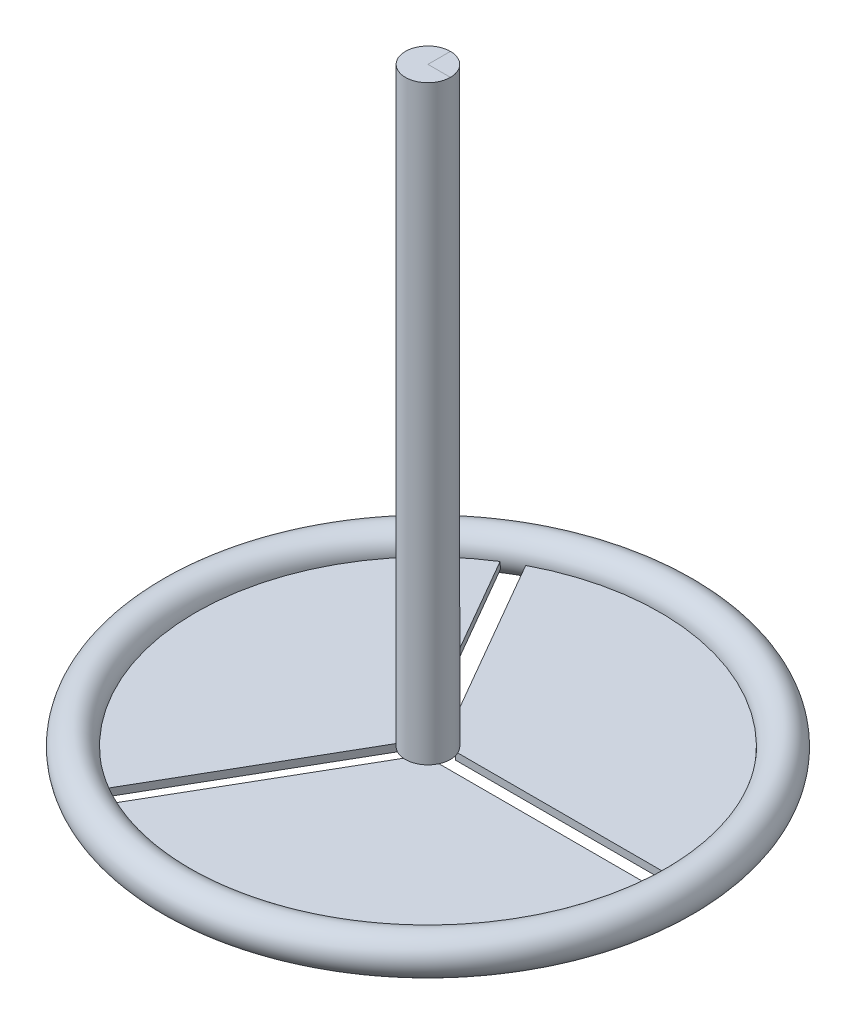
SolidWorks part; units mm, degrees
ref_plane "Front Plane" through (0, 0, 0) normal (0, 0, 1) x (1, 0, 0)
ref_plane "Top Plane" through (0, 0, 0) normal (0, 1, 0) x (1, 0, 0)
ref_plane "Right Plane" through (0, 0, 0) normal (1, 0, 0) x (0, 0, -1)
ref_plane "Plane1" through (0, 193.5413, -979.8028) normal (0, -0.1938, 0.981) x (1, 0, 0)
sketch "Sketch1" plane through (0, 0, -1215.3142) normal (0, 1, 0) x (1, 0, 0)
  line L0 (-200.97, -1215.3142) -> (200.97, -1215.3142) construction
  line L1 (0, -1416.2842) -> (0, -1014.3442) construction
  circle A0 centre (0, -1215.3142) radius 170
extrude "Extrude1" add sketch "Sketch1" against normal blind 5
sketch "Sketch3" plane through (0, -5, 0) normal (0, -1, 0) x (-1, 0, 0)
  circle A0 centre (0, 0) radius 13.97
  dimension "D1" = 27.94
extrude "Cut-Extrude1" cut sketch "Sketch3" against normal through all
sketch "Sketch4" plane through (0, -5, 0) normal (0, -1, 0) x (-1, 0, 0)
  line L0 (0, 0) -> (548.0113, 0) construction
  line L1 (0, 0) -> (84.3463, -146.0921) construction
  line L2 (0, 0) -> (504.6147, 874.0183) construction
  line L4 (725.1893, 497.3832) -> (737.8893, 497.3832)
  line L5 (725.1893, 497.3832) -> (800.3254, 627.5227)
  line L6 (800.3254, 627.5227) -> (813.0254, 627.5227)
  line L7 (737.8893, 497.3832) -> (813.0254, 627.5227)
  line L8 (572.2578, -6.35) -> (720.7058, -6.35)
  line L9 (572.2578, -6.35) -> (572.2578, 6.35)
  line L10 (572.2578, 6.35) -> (720.7058, 6.35)
  line L11 (720.7058, -6.35) -> (720.7058, 6.35)
  line L12 (75.1174, -142.8063) -> (86.0439, -136.3331)
  line L13 (75.1174, -142.8063) -> (-5.4632, -3.2366)
  line L14 (-5.4632, -3.2366) -> (5.4632, 3.2366)
  line L15 (86.0439, -136.3331) -> (5.4632, 3.2366)
  dimension "D1" = 120
  dimension "D2" = 120
  dimension "D3" = 12.7
  dimension "D4" = 12.7
  dimension "D5" = 12.7
extrude "Cut-Extrude2" cut sketch "Sketch4" against normal through all
pattern_circular "CirPattern1" count 3 over 360 about axis through (0, 0, 0) along (0, 1, 0) of "Cut-Extrude2"
sketch "Sketch6" plane through (0, 0, 0) normal (0, 1, 0) x (1, 0, 0)
  circle A0 centre (0, 0) radius 15.24
  dimension "D1" = 30.48
extrude "Extrude2" add sketch "Sketch6" along normal blind 400.05
sketch "Sketch7" plane through (0, 0, 0) normal (0, 0, 1) x (1, 0, 0)
  line L0 (170, 0) -> (-170, 0) construction
  line L7 (170, 0) -> (-170, 0) construction
  circle A0 centre (-170, 0) radius 12.7
  dimension "D1" = 25.4
revolve "Revolve2" add sketch "Sketch7" angle 360 about axis through (0, 400.05, 0) along (0, -1, 0)
sketch "Sketch8" plane through (0, 400.05, 0) normal (0, 1, 0) x (-1, 0, 0)
  line L1 (0, 0) -> (-38.0151, 0)
  line L2 (0, 0) -> (0, -32.5399)
  line L3 (0, -32.5399) -> (-38.0151, -32.5399)
  line L4 (-38.0151, 0) -> (-38.0151, -32.5399)
